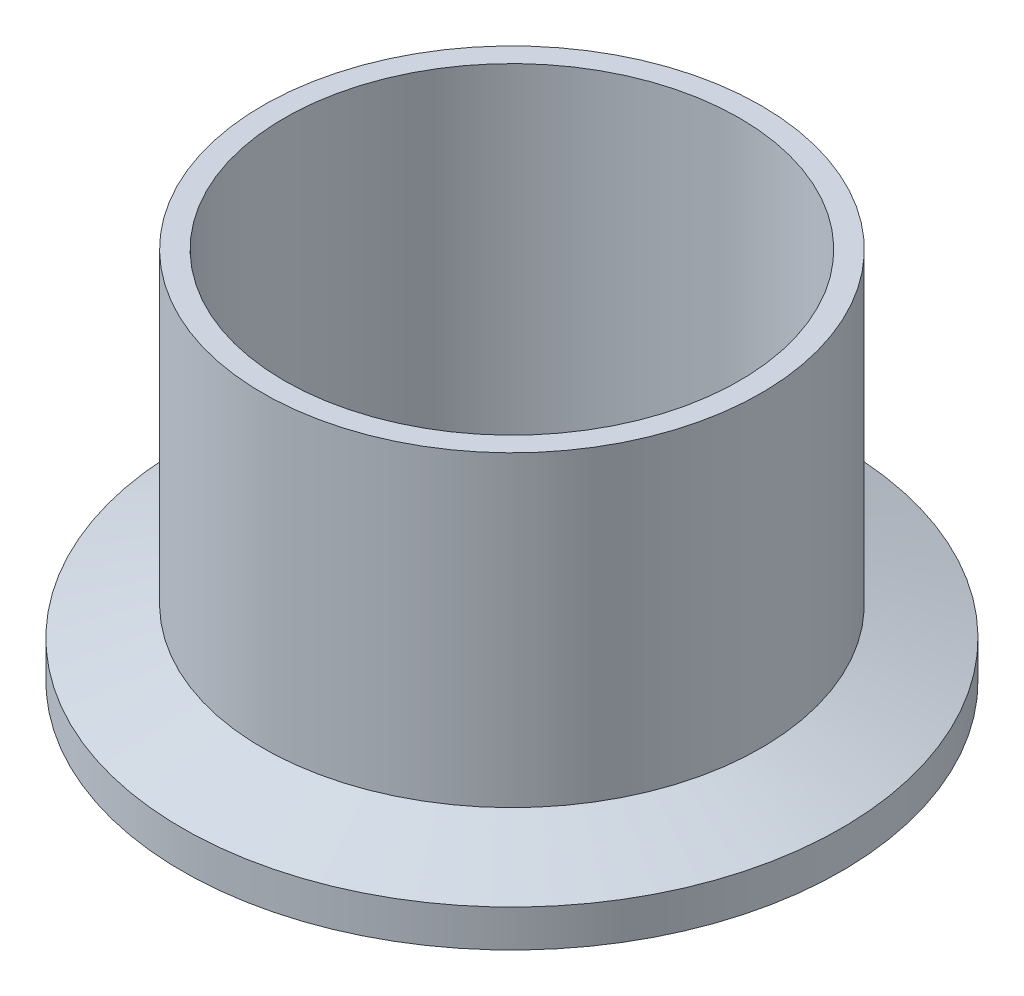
SolidWorks part; units mm, degrees
ref_plane "Front Plane" through (0, 0, 0) normal (0, 0, 1) x (1, 0, 0)
ref_plane "Top Plane" through (0, 0, 0) normal (0, 1, 0) x (1, 0, 0)
ref_plane "Right Plane" through (0, 0, 0) normal (1, 0, 0) x (0, 0, -1)
sketch "Sketch1" plane through (0, 0, 0) normal (0, 0, 1) x (1, 0, 0)
  line L0 (0, 0) -> (0, 28.575) construction
  line L1 (0, 28.575) -> (-19.05, 28.575)
  line L2 (-19.05, 28.575) -> (-19.05, 5.0821)
  line L3 (-19.05, 5.0821) -> (-25.1968, 2.8448)
  line L4 (-25.1968, 2.8448) -> (-25.1968, 0)
  line L5 (-25.1968, 0) -> (-23.6366, 0)
  line L6 (-20.0006, 0) -> (0, 0)
  line L7 (0, 0) -> (0, 28.575)
  line L8 (0, 28.575) -> (-17.399, 28.575)
  line L9 (-17.399, 28.575) -> (-17.399, 0)
  line L10 (-17.399, 0) -> (0, 0)
  line L11 (0, 0) -> (-0.1846, 0.0129)
  arc A0 (-22.9141, 0.4745) -> (-20.7231, 0.4745) centre (-21.8186, 0) cw
  arc A1 (-20.0006, 0) -> (-20.7231, 0.4745) centre (-20.0006, 0.7874) cw
  arc A2 (-22.9141, 0.4745) -> (-23.6366, 0) centre (-23.6366, 0.7874) cw
  point P12 (-20.6248, 0)
  dimension "D6" = 1.1938
  dimension "D7" = 0.7874
  dimension "D1" = 19.05
  dimension "D2" = 2.8448
  dimension "D3" = 25.1968
  dimension "D4" = 70
  dimension "D5" = 21.8186
  dimension "D8" = 1.651
  dimension "D9" = 28.575
revolve "Revolve2" add sketch "Sketch1" angle 360 about L0
